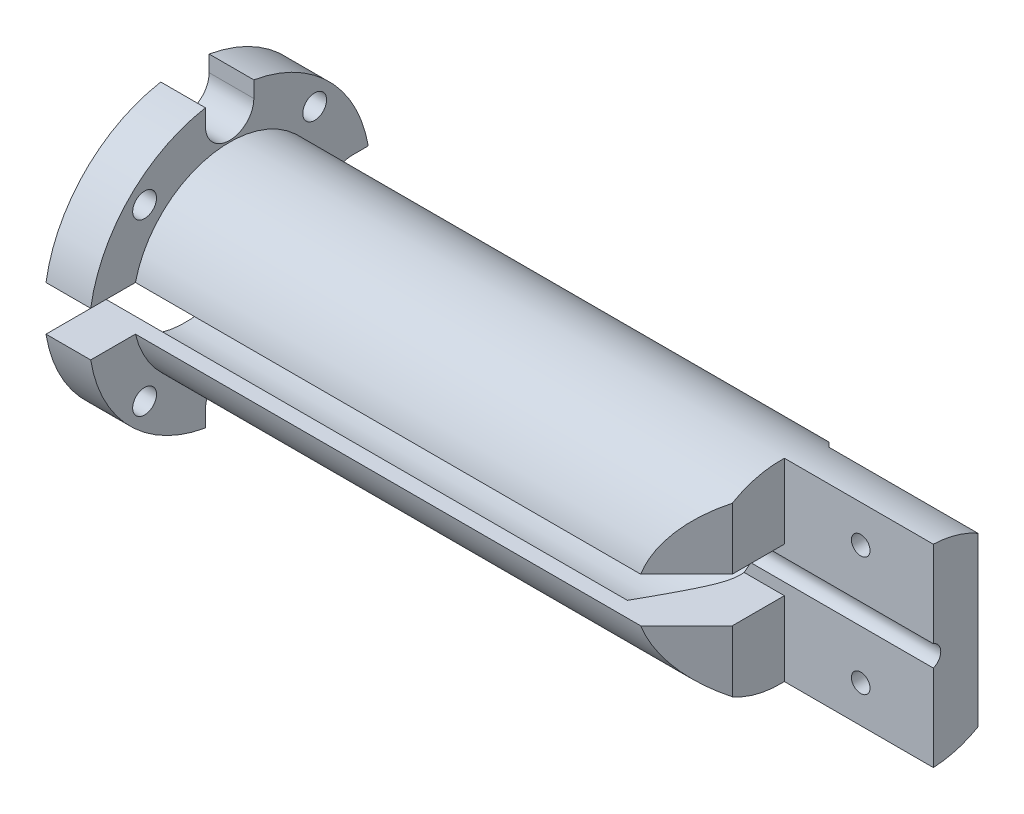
SolidWorks part; units mm, degrees
ref_plane "Vorne" through (0, 0, 0) normal (0, 0, 1) x (1, 0, 0)
ref_plane "Oben" through (0, 0, 0) normal (0, 1, 0) x (1, 0, 0)
ref_plane "Rechts" through (0, 0, 0) normal (1, 0, 0) x (0, 0, -1)
sketch "Skizze1" plane through (0, 0, 0) normal (0, 0, 1) x (1, 0, 0)
  line L0 (0, 0) -> (94.9478, 0) construction
  line L1 (0, 11) -> (70, 11)
  line L2 (70, 11) -> (75.4848, 1.5)
  line L3 (75.4848, 1.5) -> (100, 1.5)
  line L4 (100, 1.5) -> (100, 13)
  line L7 (100, 13) -> (6, 13)
  line L8 (6, 13) -> (6, 18.9)
  line L9 (6, 18.9) -> (0, 18.9)
  line L10 (0, 18.9) -> (0, 11)
  dimension "D1" = 22
  dimension "D2" = 26
  dimension "D3" = 3
  dimension "D5" = 6
  dimension "D7" = 100
  dimension "D9" = 60
  dimension "D10" = 70
  dimension "D11" = 37.8
revolve "Rotation1" add sketch "Skizze1" angle 360 about L0
sketch "Skizze2" plane through (0, 0, 0) normal (-1, 0, 0) x (0, 0, 1)
  line L0 (18.6604, 3) -> (-0.5, 3)
  line L1 (-0.5, 3) -> (-0.5, -3)
  line L2 (-0.5, -3) -> (18.6604, -3)
  circle A0 centre (0, 0) radius 18.9 construction
  arc A1 (18.6604, -3) -> (18.6604, 3) centre (0, 0) ccw
  dimension "D1" = 0.5
  dimension "D2" = 3
  dimension "D3" = 6
extrude "Linear austragen1" cut sketch "Skizze2" against normal through all
sketch "Skizze3" plane through (0, 0, 0) normal (0, 1, 0) x (1, 0, 0)
  line L0 (100, 6.5) -> (80, 6.5)
  line L1 (100, -12.6491) -> (100, 13) construction
  line L2 (80, 6.5) -> (73.5, 13)
  line L3 (100, 13) -> (6, 13) construction
  line L4 (100, 13) -> (73.5, 13)
  line L5 (100, 6.5) -> (100, 13)
  line L6 (100, 0) -> (75.4848, 0) construction
  dimension "D1" = 6.5
  dimension "D2" = 135
  dimension "D3" = 20
extrude "Linear austragen2" cut sketch "Skizze3" against normal through all and the other way through all
mirror "Spiegeln1" about plane through (0, 0, 0) normal (0, 0, 1) of "Linear austragen2"
sketch "Skizze4" plane through (0, 0, 6.5) normal (0, 0, 1) x (1, 0, 0)
  line L0 (100, 3) -> (100, 11.2583) construction
  line L1 (100, -13) -> (100, 13)
  line L2 (80, 3) -> (80, 11.2583) construction
  line L3 (80, -13) -> (80, 13)
  line L4 (100, 13) -> (6, 13) construction
  line L5 (100, 13) -> (80, 13)
  line L6 (6, -13) -> (100, -13) construction
  line L7 (80, -13) -> (100, -13)
extrude "Linear austragen3" cut sketch "Skizze4" against normal up to surface (7 mm away)
sketch "Skizze5" plane through (0, 0, 0) normal (-1, 0, 0) x (0, 0, 1)
  line L0 (-3.25, -16.45) -> (-3.25, -18.6185)
  line L1 (3.25, -16.45) -> (3.25, -18.6185)
  arc A0 (3.25, -16.45) -> (-3.25, -16.45) centre (0, -16.45) ccw
  arc A1 (18.6604, 3) -> (18.6604, -3) centre (0, 0) ccw construction
  arc A2 (-3.25, -18.6185) -> (3.25, -18.6185) centre (0, 0) ccw
  arc A3 (12.6491, 3) -> (12.6491, -3) centre (0, 0) ccw construction
  dimension "D1" = 3.25
  dimension "D2" = 0.2
extrude "Linear austragen4" cut sketch "Skizze5" against normal up to next
pattern_circular "Kreismuster1" count 3 every 90 about axis through (0, 0, 0) along (1, 0, 0) of "Linear austragen4"
hole_wizard "Ø3.2 (3.2) Durchmesser Bohrung1" positions "Skizze7" profile "Skizze8" hole size "Ø3.2" standard "ISO"
sketch "Skizze7" plane through (0, 0, 0) normal (-1, 0, 0) x (0, 0, 1)
  line L0 (-11.4198, 11.4198) -> (0, 0) construction
  line L1 (0, 0) -> (-16.45, 0) construction
  point P0 (-11.4198, 11.4198)
  dimension "D1" = 45
  dimension "D2" = 16.15
sketch "Skizze8" plane through (0, 11.4198, -11.4198) normal (0, 1, 0) x (0, 0, 1)
  line L0 (0, 0) -> (0, 6.001)
  line L1 (0, 6.001) -> (1.6, 6.001)
  line L2 (1.6, 6.001) -> (1.6, 0)
  line L5 (1.6, 0) -> (0, 0)
  line L11 (0, -6.35) -> (0, 107.95) construction
  dimension "Bohrerdurchmesser" = 3.2
  dimension "Bohrungstiefe" = 6.001
pattern_circular "Kreismuster2" count 4 over 360 about axis through (0, 0, 0) along (1, 0, 0) of "Ø3.2 (3.2) Durchmesser Bohrung1"
hole_wizard "M3 Gewindebohrung1" positions "Skizze10" profile "Skizze11" tap size "M3" standard "ISO"
sketch "Skizze10" plane through (0, 0, -0.5) normal (0, 0, 1) x (1, 0, 0)
  line L0 (100, 12.9904) -> (100, 1.4142) construction
  line L1 (100, 0) -> (80, 0) construction
  point P0 (90.25, 8)
  point P1 (90.25, -8)
  dimension "D1" = 9.75
  dimension "D2" = 8
  dimension "D3" = 16
sketch "Skizze11" plane through (90.25, 8, -0.5) normal (1, 0, 0) x (0, -1, 0)
  line L0 (0, 0) -> (0, 6)
  line L1 (0, 6) -> (1.25, 6)
  line L2 (1.25, 6) -> (1.25, 0)
  line L5 (1.25, 0) -> (0, 0)
  line L11 (0, -6.35) -> (0, 107.95) construction
  dimension "Bohrerdurchmesser" = 2.5
  dimension "Bohrungstiefe" = 6
